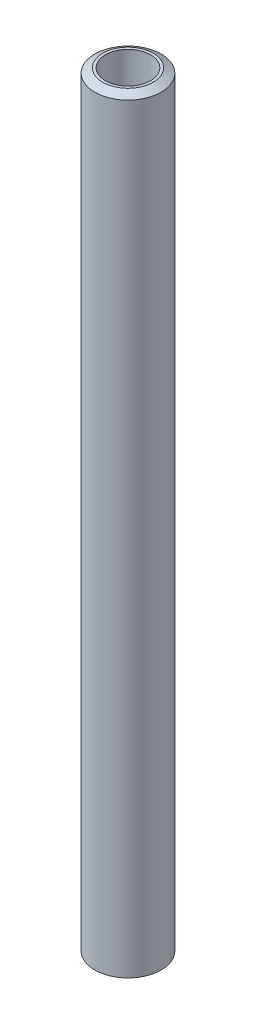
SolidWorks part; units mm, degrees
ref_plane "Přední rovina" through (0, 0, 0) normal (0, 0, 1) x (1, 0, 0)
ref_plane "Horní rovina" through (0, 0, 0) normal (0, 1, 0) x (1, 0, 0)
ref_plane "Pravá rovina" through (0, 0, 0) normal (1, 0, 0) x (0, 0, -1)
sketch "Skica1" plane through (0, 0, 0) normal (0, 1, 0) x (1, 0, 0)
  circle A0 centre (0, 0) radius 12.5
  dimension "D1" = 25
extrude "Přidat vysunutím1" add sketch "Skica1" along normal blind 290
sketch "Skica2" plane through (0, 290, 0) normal (0, 1, 0) x (1, 0, 0)
  circle A0 centre (0, 0) radius 8.5
  dimension "D1" = 17
extrude "Odebrat vysunutím1" cut sketch "Skica2" against normal through all
chamfer "Zkosení1" distance 3 distance2 1.75 1 edges at (0, 0, 12.5)
chamfer "Zkosení2" distance 1.75 distance2 3 1 edges at (0, 290, 12.5)
